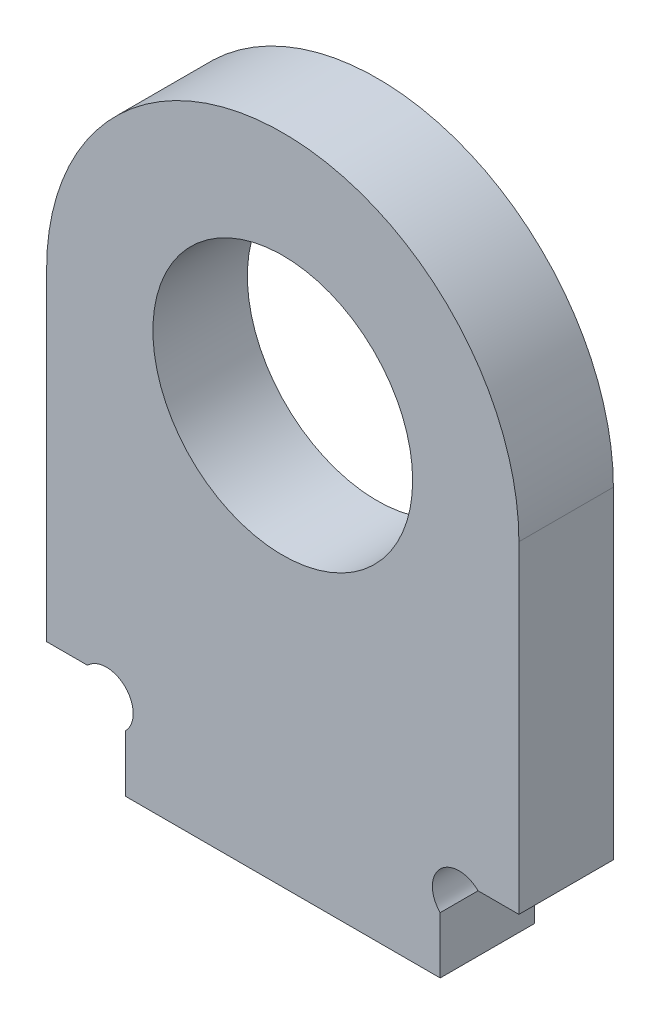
SolidWorks part; units mm, degrees
ref_plane "Plan de face" through (0, 0, 0) normal (0, 0, 1) x (1, 0, 0)
ref_plane "Plan de dessus" through (0, 0, 0) normal (0, 1, 0) x (1, 0, 0)
ref_plane "Plan de droite" through (0, 0, 0) normal (1, 0, 0) x (0, 0, -1)
sketch "Esquisse1" plane through (0, 0, 0) normal (0, 0, 1) x (1, 0, 0)
  line L0 (-10.4669, 0) -> (57.6462, 0) construction
  line L1 (0, -14.8412) -> (0, 55.7716) construction
  line L2 (15, -14.8412) -> (15, 55.7716) construction
  line L3 (30, -14.8412) -> (30, 55.7716) construction
  line L4 (-7.6536, 6) -> (39.4439, 6) construction
  line L5 (-7.6536, 26.5) -> (40.6213, 26.5) construction
  line L6 (5, 10.5507) -> (5, -6.7684) construction
  line L7 (25, 9.3261) -> (25, -3.0946) construction
  line L8 (5, 6) -> (0.8629, 1.8629) construction
  line L9 (0, 26.5) -> (0, 6)
  line L10 (0, 6) -> (2.5958, 6)
  line L11 (5, 3.5958) -> (5, 0)
  line L12 (5, 0) -> (25, 0)
  line L13 (25, 0) -> (25, 3.5958)
  line L14 (27.4042, 6) -> (30, 6)
  line L15 (30, 6) -> (30, 26.5)
  arc A0 (30, 26.5) -> (0, 26.5) centre (15, 26.5) ccw
  arc A1 (5, 3.5958) -> (2.5958, 6) centre (3.7979, 4.7979) ccw
  arc A2 (25, 3.5958) -> (27.4042, 6) centre (26.2021, 4.7979) cw
  circle A3 centre (15, 26.5) radius 8.25
extrude "Extrusion1" add sketch "Esquisse1" along normal blind 6
